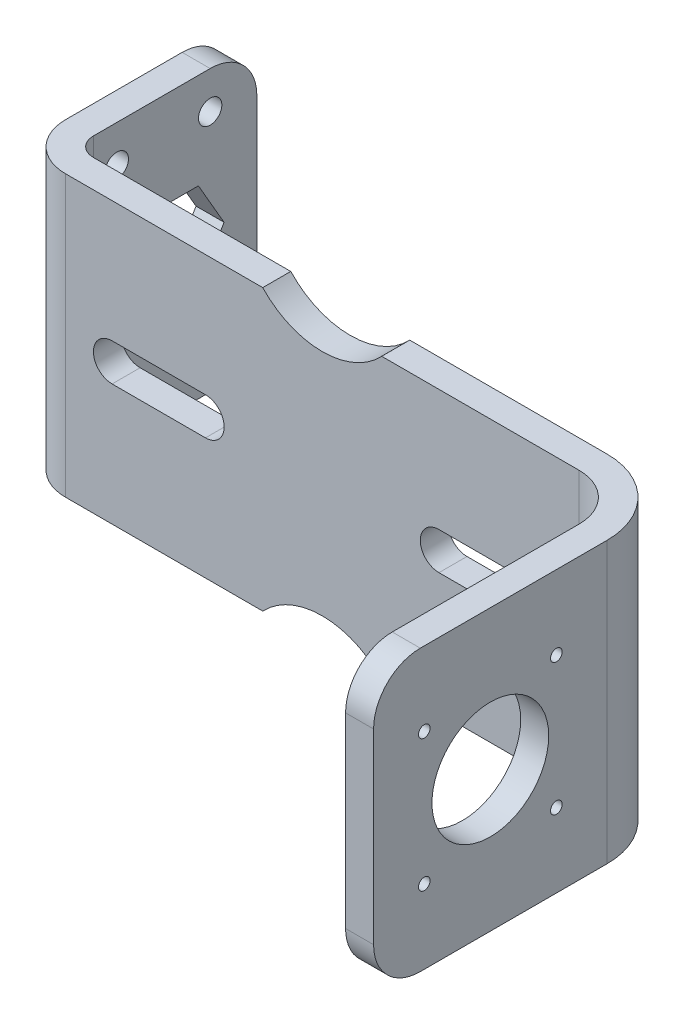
SolidWorks part; units mm, degrees
ref_plane "Ebene vorne" through (0, 0, 0) normal (0, 0, 1) x (1, 0, 0)
ref_plane "Ebene oben" through (0, 0, 0) normal (0, 1, 0) x (1, 0, 0)
ref_plane "Ebene rechts" through (0, 0, 0) normal (1, 0, 0) x (0, 0, -1)
sketch "Skizze1" plane through (0, 0, 0) normal (0, 1, 0) x (1, 0, 0)
  line L0 (0, 0) -> (0, 60) construction
  line L1 (0, 60) -> (55, 60)
  line L2 (65, 50) -> (65, 0)
  line L3 (0, 60) -> (-55, 60)
  line L4 (-65, 70) -> (-65, 105)
  arc A0 (55, 60) -> (65, 50) centre (55, 50) cw
  arc A1 (-55, 60) -> (-65, 70) centre (-55, 70) cw
  point P3 (0, 0)
  point P10 (65, 60)
  point P13 (-65, 60)
  dimension "D4" = 10
  dimension "D1" = 130
  dimension "D2" = 45
  dimension "D3" = 60
extrude "Linear-Austragen-Dünn1" add sketch "Skizze1" along normal blind 60 thin
sketch "Skizze2" plane through (71, 0, 0) normal (1, 0, 0) x (0, 0, -1)
  line L0 (0, 60) -> (0, 0) construction
  line L1 (0, 60) -> (50, 60) construction
  circle A0 centre (25, 30) radius 12.5
  dimension "D3" = 25
  dimension "D1" = 25
  dimension "D2" = 30
extrude "Schnitt-Linear austragen1" cut sketch "Skizze2" against normal through all
sketch "Skizze3" plane through (71, 0, 0) normal (1, 0, 0) x (0, 0, -1)
  line L0 (25, 30) -> (25, 50) construction
  line L1 (25, 30) -> (10.8579, 44.1421) construction
  circle A0 centre (25, 30) radius 20 construction
  dimension "D2" = 40
  dimension "D1" = 45
hole_wizard "M3 Gewindebohrung1" positions "3D-Skizze1" profile "Skizze4" tap size "M3" standard "DIN"
sketch3d "3D-Skizze1"
  point P0 (71, 44.1421, -10.8579)
sketch "Skizze4" plane through (71, 44.1421, -10.8579) normal (0, 1, 0) x (0, 0, -1)
  line L0 (0, 0) -> (0, 136)
  line L1 (0, 136) -> (1.25, 136)
  line L2 (1.25, 136) -> (1.25, 0)
  line L5 (1.25, 0) -> (0, 0)
  line L11 (0, -6.35) -> (0, 107.95) construction
  dimension "Bohrerdurchmesser" = 2.5
  dimension "Bohrungstiefe" = 136
pattern_curve "Kurvenmuster1" of "M3 Gewindebohrung1" parameters "D1"=4, "D3"=10, "D2"=1, "D4"=10
sketch "Skizze5" plane through (-59, 0, 0) normal (1, 0, 0) x (0, 0, -1)
  line L0 (70, 60) -> (105, 60) construction
  line L1 (105, 60) -> (105, 0) construction
  circle A0 centre (75, 52) radius 2.5
  dimension "D3" = 5
  dimension "D1" = 8
  dimension "D2" = 30
extrude "Schnitt-Linear austragen2" cut sketch "Skizze5" against normal through all
pattern_linear "Lineares Muster1" count 2 spacing 20 along (0, 0, -1) count 2 spacing 45 along (0, -1, 0) of "Schnitt-Linear austragen2"
sketch "Skizze6" plane through (0, 0, -60) normal (0, 0, 1) x (1, 0, 0)
  line L0 (-45, 30) -> (-25, 30) construction
  line L1 (-45, 34) -> (-25, 34)
  line L2 (-45, 26) -> (-25, 26)
  line L3 (55, 60) -> (-55, 60) construction
  line L5 (-65, 60) -> (-65, 0) construction
  arc A0 (-45, 34) -> (-45, 26) centre (-45, 30) ccw
  arc A1 (-25, 26) -> (-25, 34) centre (-25, 30) ccw
  point P2 (-35, 30)
  dimension "D1" = 8
  dimension "D2" = 20
  dimension "D3" = 30
  dimension "D4" = 20
extrude "Schnitt-Linear austragen3" cut sketch "Skizze6" against normal through all
mirror "Spiegeln1" about plane through (0, 0, 0) normal (1, 0, 0) of "Schnitt-Linear austragen3"
sketch "Skizze7" plane through (0, 0, -60) normal (0, 0, 1) x (1, 0, 0)
  line L0 (-49, 30) -> (49, 30) construction
  line L1 (0, 0) -> (0, 60) construction
  line L2 (55, 0) -> (-55, 0) construction
  line L3 (55, 60) -> (-55, 60) construction
  arc A0 (-45, 34) -> (-45, 26) centre (-45, 30) ccw construction
  arc A1 (45, 26) -> (45, 34) centre (45, 30) ccw construction
  circle A2 centre (0, 72) radius 17.5
  circle A3 centre (0, -12) radius 17.5
  point P16 (0, 0)
  dimension "D1" = 35
  dimension "D2" = 12
extrude "Schnitt-Linear austragen4" cut sketch "Skizze7" against normal through all
sketch "Skizze8" plane through (-59, 0, 0) normal (1, 0, 0) x (0, 0, -1)
  line L1 (92.4848, 20.5) -> (97.9697, 30)
  line L2 (97.9697, 30) -> (92.4848, 39.5)
  line L3 (92.4848, 39.5) -> (81.5152, 39.5)
  line L4 (81.5152, 39.5) -> (76.0303, 30)
  line L5 (76.0303, 30) -> (81.5152, 20.5)
  line L6 (81.5152, 20.5) -> (92.4848, 20.5)
  line L7 (70, 60) -> (105, 60) construction
  line L8 (105, 60) -> (105, 0) construction
  line L9 (70, 0) -> (105, 0) construction
  circle A0 centre (87, 30) radius 9.5 construction
  dimension "D1" = 19
  dimension "D2" = 18
  dimension "D3" = 30
extrude "Schnitt-Linear austragen5" cut sketch "Skizze8" against normal through all
fillet "Verrundung1" radius 10 2 edges at (68, 0, 0) (68, 60, 0)
fillet "Verrundung2" radius 10 2 edges at (-62, 0, -105) (-62, 60, -105)
